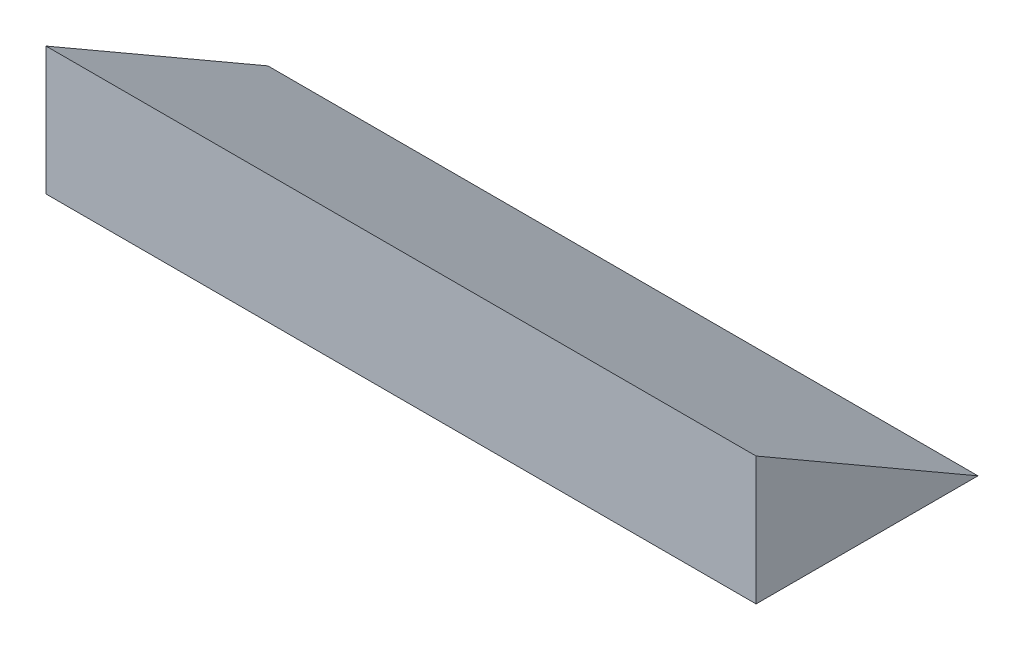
SolidWorks part; units mm, degrees
ref_plane "Plan de face" through (0, 0, 0) normal (0, 0, 1) x (1, 0, 0)
ref_plane "Plan de dessus" through (0, 0, 0) normal (0, 1, 0) x (1, 0, 0)
ref_plane "Plan de droite" through (0, 0, 0) normal (1, 0, 0) x (0, 0, -1)
sketch "Esquisse1" plane through (0, 0, 0) normal (1, 0, 0) x (0, 0, -1)
  line L0 (0, 0) -> (500, 0)
  line L1 (500, 0) -> (0, 288.6751)
  line L2 (0, 0) -> (0, 288.6751)
  dimension "D1" = 30
  dimension "D2" = 500
extrude "Boss.-Extru.1" add sketch "Esquisse1" along normal blind 1600
sketch "Esquisse2" plane through (0, 0, 0) normal (0, -1, 0) x (1, 0, 0)
  line L0 (800, -500) -> (800, 0) construction
  line L1 (1600, -500) -> (0, -500) construction
  line L2 (1600, 0) -> (0, 0) construction
  line L3 (800, -250) -> (258.9561, -250) construction
  circle A0 centre (550, -250) radius 5
  circle A1 centre (1050, -250) radius 5
  dimension "D1" = 250
extrude "Enlèv. mat.-Extru.1" cut sketch "Esquisse2" against normal blind 10
